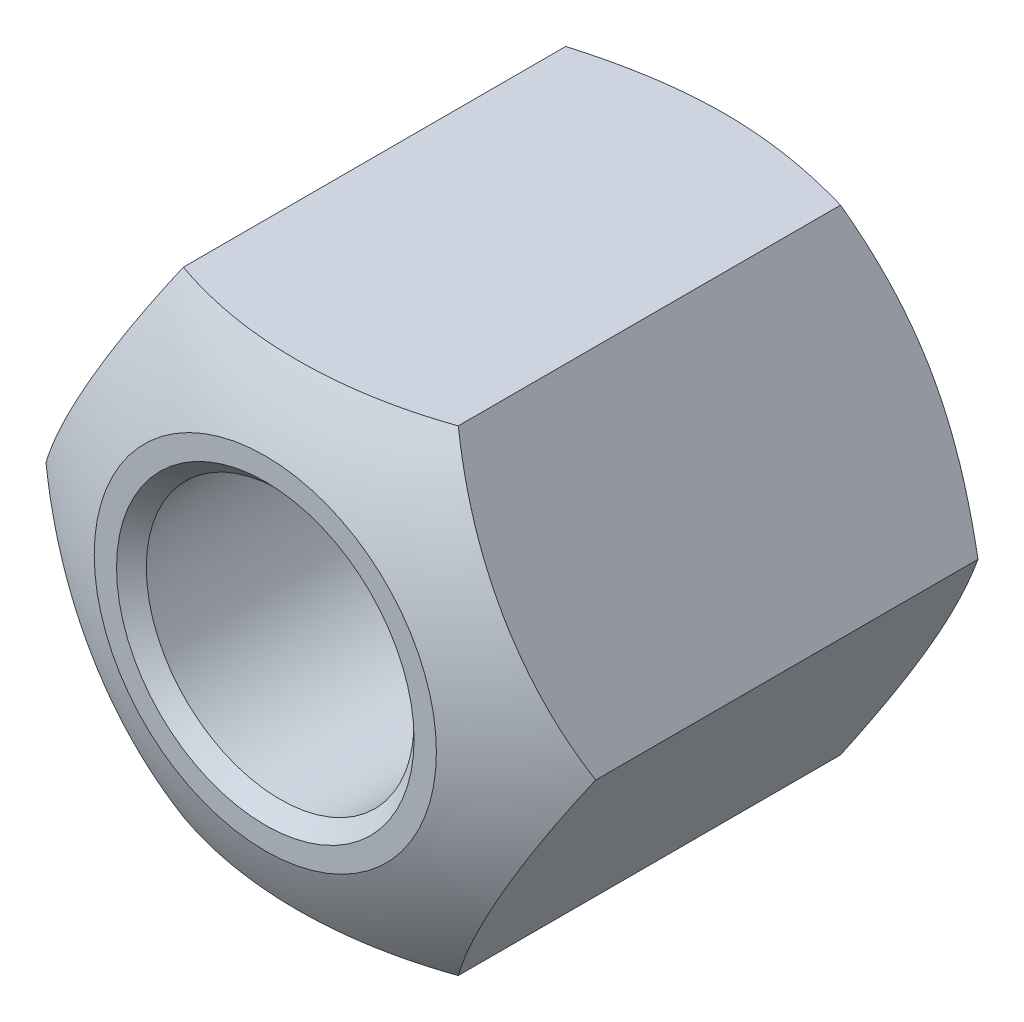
SolidWorks part; units mm, degrees
ref_plane "Front" through (0, 0, 0) normal (0, 0, 1) x (1, 0, 0)
ref_plane "Top" through (0, 0, 0) normal (0, 1, 0) x (1, 0, 0)
ref_plane "Right" through (0, 0, 0) normal (1, 0, 0) x (0, 0, -1)
sketch "Sketch1" plane through (0, 0, 0) normal (0, 0, 1) x (1, 0, 0)
  line L1 (4.6188, -8) -> (9.2376, 0)
  line L2 (9.2376, 0) -> (4.6188, 8)
  line L3 (4.6188, 8) -> (-4.6188, 8)
  line L4 (-4.6188, 8) -> (-9.2376, 0)
  line L5 (-9.2376, 0) -> (-4.6188, -8)
  line L6 (-4.6188, -8) -> (4.6188, -8)
  circle A0 centre (0, 0) radius 8 construction
  circle A1 centre (0, 0) radius 4.5
  dimension "D1" = 9
  dimension "s" = 16
extrude "BaseNut" add sketch "Sketch1" against normal blind 16.35
sketch "Sketch2" plane through (-4.3776, 0, -4.86) normal (0, 1, 0) x (0, 0, 1)
  line L0 (-10.092, 4.3776) -> (10.5743, 4.3776) construction
  line L4 (2.9928, 13.6152) -> (4.86, 13.6152)
  line L5 (4.86, 13.6152) -> (4.86, 10.1276)
  arc A0 (2.9928, 13.6152) -> (4.86, 10.1276) centre (-10.0711, 4.3776) cw
  dimension "R" = 16
  dimension "d" = 11.5
revolve "EndChamfer1" cut sketch "Sketch2" angle 360 about L0
sketch "Sketch3" plane through (-4.6188, 0, -4.6188) normal (0, 1, 0) x (0, 0, 1)
  line L0 (9.4241, 4.6188) -> (-9.4241, 4.6188) construction
  line L1 (-11.7312, 11.0245) -> (-11.7312, 13.8564)
  line L3 (-11.7312, 13.8564) -> (-10.0962, 13.8564)
  line L5 (-10.0962, 13.8564) -> (-11.7312, 11.0245)
  dimension "D1" = 30
  dimension "D2" = 1.635
revolve "EndChamfer2" cut sketch "Sketch3" angle 360 about L0
chamfer "Chamfer1" distance 0.5 angle 45 2 edges at (4.5, 0, 0) (4.5, 0, -16.35)
sketch "Sketch4" plane through (0, 0, 0) normal (0, 1, 0) x (1, 0, 0)
  line L0 (-4.933, 0.5) -> (-4.5, 0.75)
  line L1 (-4.5, 0.75) -> (-4, 0.75)
  line L2 (-4, 0.75) -> (-4, 0.25)
  line L3 (-4, 0.25) -> (-4.5, 0.25)
  line L4 (-4.5, 0.25) -> (-4.933, 0.5)
  line L5 (0, 0) -> (0, -6.6415) construction
  line L8 (-4.5, 0.5) -> (4.5, 0.5) construction
  dimension "D1" = 0.5
  dimension "D2" = 9
revolve "Cut-Revolve10" [suppressed] cut sketch "Sketch4" angle 360 about L5
pattern_linear "LPattern10" [suppressed] count 26 spacing 0.6 along (0, 0, 1)
equation "\"D2@Sketch3\" = \"m@BaseNut\" /10"
equation "\"D2@Sketch4\"=\"D1@Sketch1\""
equation "\"D1@Sketch4\"= (\"D2@ThreadCosmetic1\" -\"D2@Sketch4\"  )  / 2"
equation "\"D3@LPattern10\"=\"D1@Sketch4\" * 1.2"
equation "\"D1@Chamfer1\" =  ( \"D2@ThreadCosmetic1\" - \"D1@Sketch1\" )  / 2"
equation "\"D1@LPattern10\"= ( \"m@BaseNut\" - \"D1@Chamfer1\" )  / \"D3@LPattern10\""
